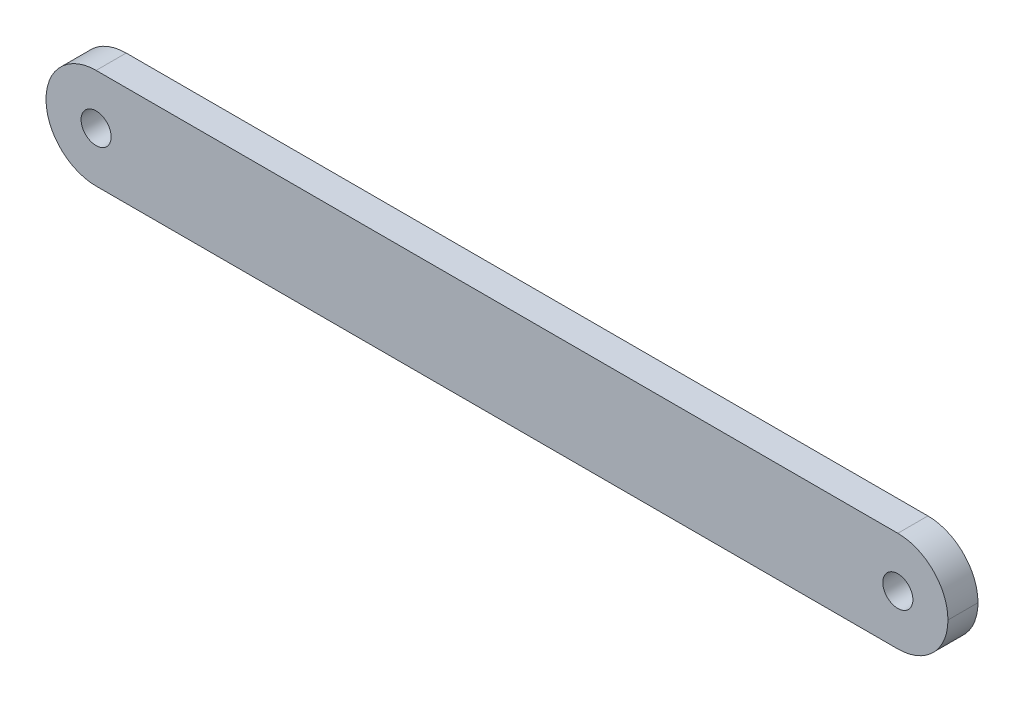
SolidWorks part; units mm, degrees
ref_plane "Plan de face" through (0, 0, 0) normal (0, 0, 1) x (1, 0, 0)
ref_plane "Plan de dessus" through (0, 0, 0) normal (0, 1, 0) x (1, 0, 0)
ref_plane "Plan de droite" through (0, 0, 0) normal (1, 0, 0) x (0, 0, -1)
sketch "Esquisse1" plane through (0, 0, 0) normal (0, 0, 1) x (1, 0, 0)
  line L1 (0, 0) -> (90, 0)
  line L2 (0, 0) -> (0, 10)
  line L3 (0, 10) -> (90, 10)
  line L4 (90, 0) -> (90, 10)
extrude "Extrusion1" add sketch "Esquisse1" along normal blind 3
fillet "Congé1" radius 5 2 edges at (90, 0, 1.5) (90, 10, 1.5)
fillet "Congé2" radius 5 2 edges at (0, 0, 1.5) (0, 10, 1.5)
sketch "Esquisse2" plane through (0, 0, 3) normal (0, 0, 1) x (1, 0, 0)
  circle A0 centre (5, 5) radius 1.5
  circle A1 centre (85, 5) radius 1.5
extrude "Extrusion2" cut sketch "Esquisse2" against normal blind 3
